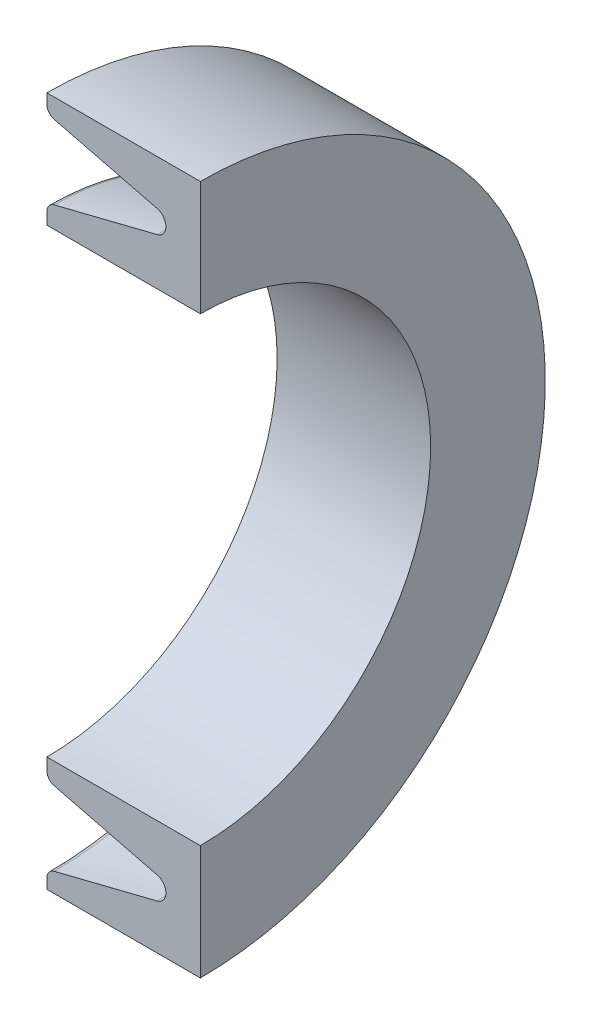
SolidWorks part; units mm, degrees
ref_plane "Plan1" through (0, 0, 0) normal (0, 0, 1) x (1, 0, 0)
ref_plane "Plan2" through (0, 0, 0) normal (0, 1, 0) x (1, 0, 0)
ref_plane "Plan3" through (0, 0, 0) normal (1, 0, 0) x (0, 0, -1)
sketch "Esquisse1" plane through (0, 0, 0) normal (0, 0, 1) x (1, 0, 0)
  line L0 (-20, 40) -> (-12.1, 40)
  line L1 (-20, 40) -> (-20, 39.3904)
  line L2 (-12.1, 40) -> (-12.1, 34.1)
  line L4 (-20, 34.1) -> (-20, 34.6096)
  line L5 (-20, 34.1) -> (-12.1, 34.1)
  line L6 (-19.6213, 38.9053) -> (-14.3283, 37.5821)
  line L7 (-14.3283, 36.4179) -> (-19.6213, 35.0947)
  line L8 (-28.1, 51.85) -> (-0.1, 51.85) construction
  arc A0 (-19.6213, 38.9053) -> (-20, 39.3904) centre (-19.5, 39.3904) cw
  arc A1 (-20, 34.6096) -> (-19.6213, 35.0947) centre (-19.5, 34.6096) cw
  arc A2 (-14.3283, 36.4179) -> (-14.3283, 37.5821) centre (-14.4739, 37) ccw
  point P10 (-20, 39)
  dimension "D3" = 0.5
  dimension "D4" = 0.6
  dimension "D1" = 7.9
  dimension "D2" = 5.9
  dimension "D5" = 17.75
revolve "Base-Révolution" add sketch "Esquisse1" angle 360 about L8
sketch "Esquisse2" plane through (-12.1, 0, 0) normal (1, 0, 0) x (0, 0, -1)
  line L0 (0, 33) -> (-19, 33)
  line L1 (0, 33) -> (0, 70)
  line L2 (-19, 70) -> (0, 70)
  line L3 (-19, 70) -> (-19, 33)
extrude "Enlèv. mat.-Extru.2" cut sketch "Esquisse2" against normal blind 50
